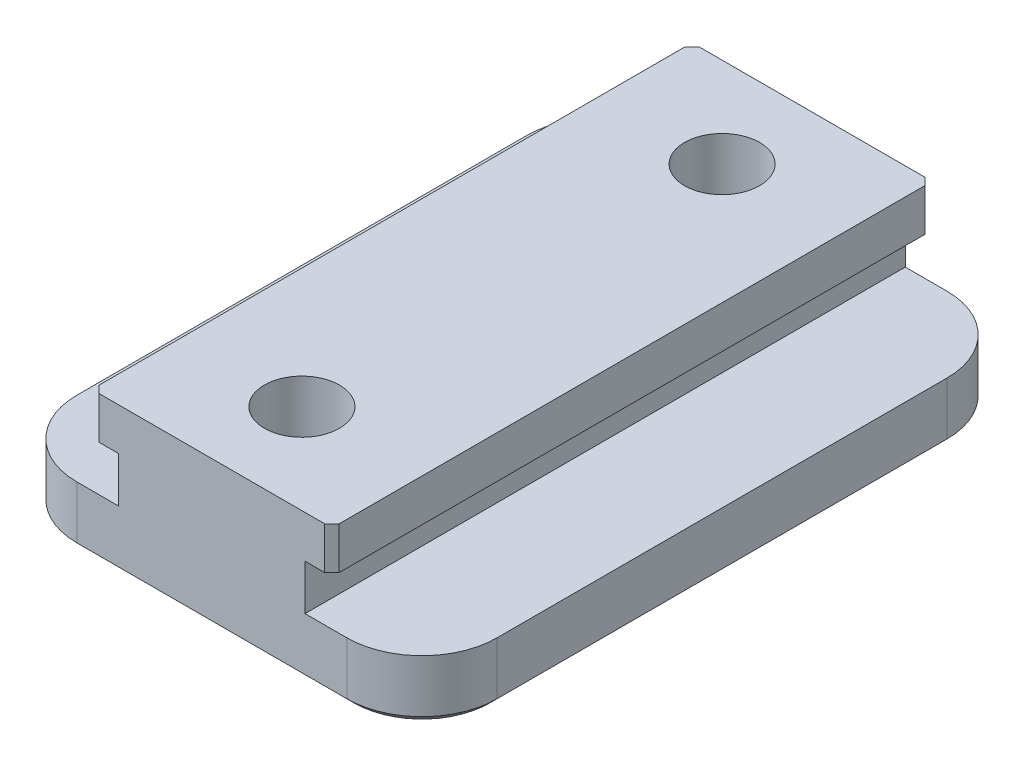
SolidWorks part; units mm, degrees
ref_plane "Front Plane" through (0, 0, 0) normal (0, 0, 1) x (1, 0, 0)
ref_plane "Top Plane" through (0, 0, 0) normal (0, 1, 0) x (1, 0, 0)
ref_plane "Right Plane" through (0, 0, 0) normal (1, 0, 0) x (0, 0, -1)
sketch "Sketch1" plane through (0, 0, 0) normal (0, 0, 1) x (1, 0, 0)
  line L0 (0, 0) -> (0, 6.3312) construction
  line L1 (12.7, 6.096) -> (-12.7, 6.096)
  line L2 (-12.7, 6.096) -> (-12.7, 1.6256)
  line L3 (-12.7, 1.6256) -> (-9.8552, 1.6256)
  line L4 (-9.8552, 1.6256) -> (-9.8552, -3.175)
  line L5 (-9.8552, -3.175) -> (-22.225, -3.175)
  line L6 (-22.225, -3.175) -> (-22.225, -9.525)
  line L7 (-22.225, -9.525) -> (22.225, -9.525)
  line L9 (22.225, -3.175) -> (22.225, -9.525)
  line L10 (9.8552, -3.175) -> (22.225, -3.175)
  line L11 (9.8552, 1.6256) -> (9.8552, -3.175)
  line L12 (12.7, 1.6256) -> (9.8552, 1.6256)
  line L13 (12.7, 6.096) -> (12.7, 1.6256)
  point P13 (0, -9.525)
  point P18 (0, 6.096)
  dimension "D1" = 25.4
  dimension "D2" = 44.45
  dimension "D3" = 6.35
  dimension "D4" = 15.621
  dimension "D5" = 4.8006
  dimension "D6" = 19.7104
  dimension "D7" = 6.096
extrude "Boss-Extrude1" add sketch "Sketch1" along normal mid plane 63.5
fillet "Fillet1" radius 7.9502 4 edges at (-22.225, -6.35, 31.75) (-22.225, -6.35, -31.75) (22.225, -6.35, -31.75) (22.225, -6.35, 31.75)
chamfer "Chamfer1" distance 0.762 angle 45 8 edges at (0, -9.525, -31.75) (-19.8964, -9.525, -29.4214) (19.8964, -9.525, -29.4214) (-22.225, -9.525, 0) (22.225, -9.525, 0) (-19.8964, -9.525, 29.4214) (19.8964, -9.525, 29.4214) (0, -9.525, 31.75)
chamfer "Chamfer3" distance 0.762 angle 45 4 edges at (12.7, 3.8608, -31.75) (-12.7, 3.8608, -31.75) (-12.7, 3.8608, 31.75) (12.7, 3.8608, 31.75)
hole_wizard " Tapped Hole1" positions "Sketch2" profile "Sketch4" tap size "3/8-16" standard "ANSI Inch"
sketch "Sketch2" plane through (0, -9.525, 0) normal (0, -1, 0) x (-1, 0, 0)
  line L0 (6.1406, 0) -> (-5.5042, 0) construction
  point P0 (0, 22.225)
  dimension "TS" = 22.225
sketch "Sketch4" plane through (0, -9.525, -22.225) normal (1, 0, 0) x (0, 0, -1)
  line L0 (0, 0) -> (0, 15.621)
  line L1 (0, 15.621) -> (3.9687, 15.621)
  line L2 (3.9687, 15.621) -> (3.9687, 0)
  line L5 (3.9687, 0) -> (0, 0)
  line L11 (0, -6.35) -> (0, 107.95) construction
  dimension "Thru Tap Drill Dia." = 7.9375
  dimension "Thru Tap Drill Depth" = 15.621
mirror "Mirror1" about plane through (0, 0, 0) normal (0, 0, 1) of " Tapped Hole1"
